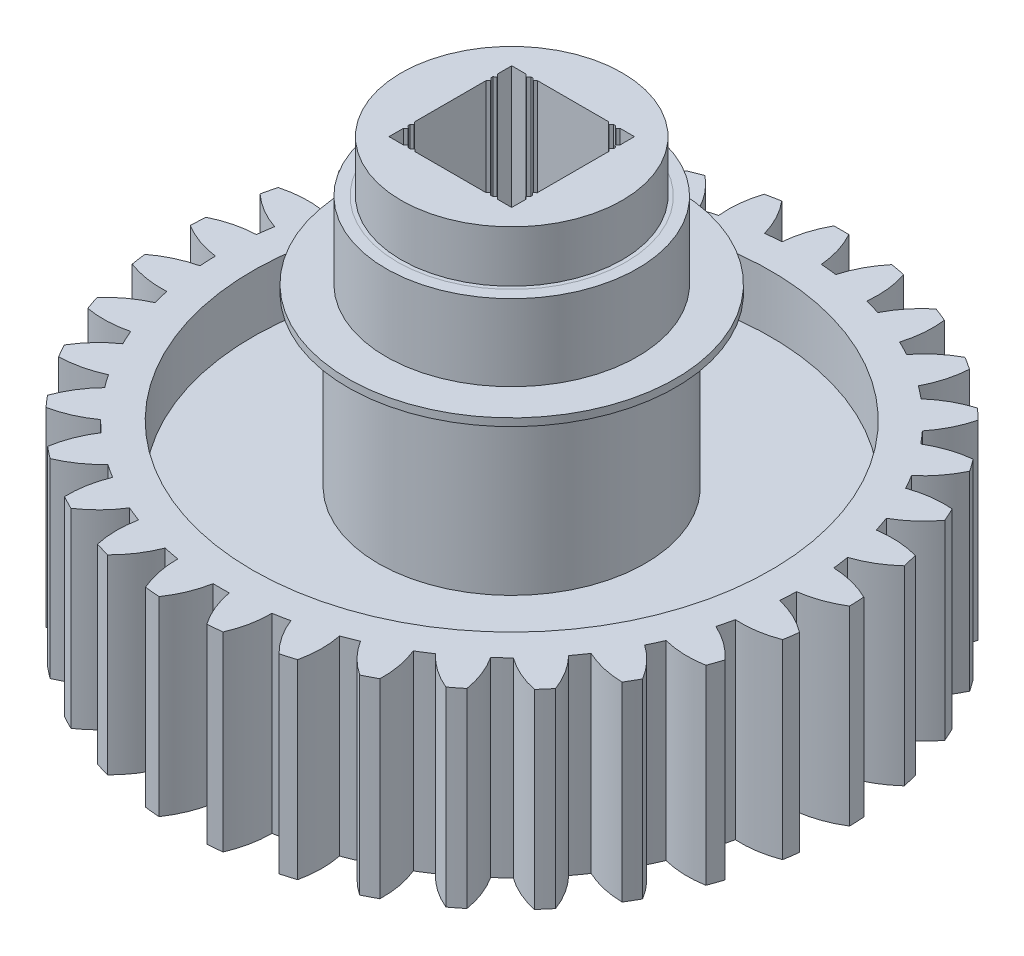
SolidWorks part; units mm, degrees
ref_plane "Front Plane" through (0, 0, 0) normal (0, 0, 1) x (1, 0, 0)
ref_plane "Top Plane" through (0, 0, 0) normal (0, 1, 0) x (1, 0, 0)
ref_plane "Right Plane" through (0, 0, 0) normal (1, 0, 0) x (0, 0, -1)
sketch "Sketch1" plane through (0, 0, 0) normal (0, 0, 1) x (1, 0, 0)
  line L0 (0, 12.8318) -> (0, 0) construction
  line L1 (-2.3, 5.1) -> (-0.3, 5.1)
  line L2 (-2.3, 5.1) -> (-2.3, 2.3)
  line L3 (-2.3, 2.3) -> (-5, 2.3)
  line L4 (-5, 2.3) -> (-5, -1.1)
  line L5 (-5, -1.1) -> (-6, -1.1)
  line L6 (-6, -1.1) -> (-6, 1.5)
  line L7 (-6, 1.5) -> (-6.8, 1.5)
  line L8 (-6.8, 1.5) -> (-6.8, 0)
  line L9 (-6.8, 0) -> (-7.57, 0)
  line L10 (-7.57, 0) -> (-7.57, 5)
  line L11 (-7.57, 5) -> (-6.8, 5)
  line L12 (-6.8, 5) -> (-6.8, 3.5)
  line L13 (-6.8, 3.5) -> (-3.5, 3.5)
  line L14 (-3.5, 3.5) -> (-3.5, 7.9)
  line L15 (-3.5, 7.9) -> (-3, 7.9)
  line L16 (-3, 7.9) -> (-3, 10.1)
  line L17 (-3, 10.1) -> (-2.9, 10.1)
  line L18 (-2.9, 10.1) -> (-2.9, 11.45)
  line L19 (-2.9, 11.45) -> (-0.3, 11.45)
  line L22 (-0.3, 11.45) -> (-0.3, 5.1)
  point P23 (0, 0)
  dimension "D2" = 0.6
  dimension "D3" = 2.8
  dimension "D4" = 2.7
  dimension "D5" = 3.4
  dimension "D6" = 2.6
  dimension "D7" = 1
  dimension "D8" = 0.8
  dimension "D9" = 1.5
  dimension "D10" = 0.77
  dimension "D11" = 5
  dimension "D12" = 3.3
  dimension "D13" = 1.5
  dimension "D14" = 0.5
  dimension "D15" = 4.4
  dimension "D16" = 0.1
  dimension "D17" = 2.2
  dimension "D18" = 15.14
  dimension "D19" = 1.35
revolve "Revolve1" add sketch "Sketch1" angle 360 about L0
sketch "Sketch2" plane through (0, 11.45, 0) normal (0, 1, 0) x (1, 0, 0)
  line L0 (0, -1.8094) -> (0, 2.3037) construction
  line L1 (-1.61, 1.61) -> (1.61, 1.61)
  line L2 (-1.61, 1.61) -> (-1.61, -1.61)
  line L3 (-1.61, -1.61) -> (1.61, -1.61)
  line L4 (1.61, 1.61) -> (1.61, -1.61)
  point P6 (0, 0)
  dimension "D1" = 3.22
  dimension "D2" = 1.61
  dimension "D3" = 3.22
extrude "Cut-Extrude1" cut sketch "Sketch2" against normal blind 5.85
sketch "Sketch3" plane through (0, 2.3, 0) normal (0, -1, 0) x (1, 0, 0)
  line L0 (0, -5) -> (0, 4.809) construction
  line L1 (3, 3.3226) -> (3, 4)
  line L2 (-3, -4) -> (-3, -3.3226)
  line L3 (-3, 3.3226) -> (-3, 4)
  line L4 (0, -4.4) -> (0, -2.4) construction
  line L5 (3, -4) -> (3, -3.3226)
  line L6 (-2.6971, 0) -> (3.3961, 0) construction
  circle A0 centre (0, 0) radius 5 construction
  arc A1 (3.2308, 2.6837) -> (3.2308, -2.6837) centre (0, 0) cw
  arc A2 (3, 4) -> (3, -4) centre (0, 0) cw
  arc A3 (3.2308, 2.6837) -> (3, 3.3226) centre (4, 3.3226) cw
  arc A4 (3, -3.3226) -> (3.2308, -2.6837) centre (4, -3.3226) cw
  circle A5 centre (0, -3.4) radius 1
  arc A6 (-3, -3.3226) -> (-3.2308, -2.6837) centre (-4, -3.3226) ccw
  arc A7 (-3.2308, 2.6837) -> (-3, 3.3226) centre (-4, 3.3226) ccw
  arc A8 (-3, 4) -> (-3, -4) centre (0, 0) ccw
  arc A9 (-3.2308, 2.6837) -> (-3.2308, -2.6837) centre (0, 0) ccw
  circle A10 centre (0, 3.4) radius 1
  point P12 (0, 0)
  dimension "D1" = 1
  dimension "D3" = 4.2
  dimension "D4" = 5
  dimension "D5" = 1
  dimension "D6" = 1
  dimension "D2" = 3.4
  dimension "D7" = 0.6774
  dimension "D8" = 0.6774
  dimension "D9" = 8
  dimension "D10" = 3
  dimension "D11" = 0.2308
  dimension "D12" = 0.2308
extrude "Extrude1" add sketch "Sketch3" along normal blind 1.2
sketch "Sketch4" plane through (0, 0, 0) normal (0, -1, 0) x (1, 0, 0)
  circle A4 centre (0, 0) radius 7.57 construction
  arc A5 (1.2209, 7.4709) -> (-1.2235, 7.4705) centre (0, 0) ccw
  arc A7 (1.2209, 7.4709) -> (1.0032, 8.5916) centre (-1.388, 7.5456) ccw
  arc A8 (1.0032, 8.5916) -> (0.6266, 8.6273) centre (0, 0) ccw
  arc A9 (-1.0038, 8.5916) -> (-1.2235, 7.4705) centre (1.3856, 7.5413) ccw
  arc A10 (-0.6266, 8.6273) -> (-1.0038, 8.5916) centre (0, 0) ccw
  arc A11 (-0.2109, 7.6221) -> (-0.6266, 8.6273) centre (-2.7777, 7.1491) ccw
  arc A12 (0.2109, 7.6221) -> (-0.2109, 7.6221) centre (0, 0) ccw
  arc A13 (0.6266, 8.6273) -> (0.2109, 7.6221) centre (2.7777, 7.1491) ccw
  point P13 (0, 0)
  dimension "D1" = 2.61
  dimension "D2" = 2.61
  dimension "D3" = 2.61
  dimension "D4" = 2.61
  dimension "D5" = 8.65
  dimension "D6" = 8.65
  dimension "D7" = 7.625
  dimension "D8" = 1.1211
  dimension "D10" = 1.0125
  dimension "D11" = 1.01
  dimension "D12" = 0.3788
  dimension "D13" = 0.3782
  dimension "D14" = 1.0052
  dimension "D15" = 1.0052
  dimension "D16" = 7.6221
extrude "Extrude2" add sketch "Sketch4" against normal up to surface (5 mm away)
pattern_circular "CirPattern1" count 33 over 360 about axis through (0, 0, 0) along (0, 1, 0) of "Extrude2"
sketch "Sketch5" plane through (0, 11.45, 0) normal (0, 1, 0) x (-1, 0, 0)
  line L0 (-1.61, 0.941) -> (-1.62, 0.941)
  line L1 (-1.62, 0.941) -> (-1.62, 1.23)
  line L2 (0, 0) -> (-2.4566, 0) construction
  line L3 (-1.61, 1.23) -> (-1.62, 1.23)
  line L4 (1.61, 1.61) -> (-1.61, 1.61) construction
  line L5 (-1.2348, 1.61) -> (-1.1803, 1.5553)
  line L6 (-1.1623, 1.5553) -> (-1.1078, 1.61)
  line L7 (-1.1078, 1.61) -> (-1.057, 1.61)
  line L8 (-1.057, 1.61) -> (-1.0025, 1.5553)
  line L9 (-0.9845, 1.5553) -> (-0.93, 1.61)
  line L10 (-0.93, 1.61) -> (-0.93, 1.6189)
  line L11 (-0.93, 1.6189) -> (-1.2348, 1.6189)
  line L12 (-1.2348, 1.6189) -> (-1.2348, 1.61)
  line L13 (0, 0) -> (0, 2.0737) construction
  line L14 (1.2348, 1.6189) -> (1.2348, 1.61)
  line L15 (0.93, 1.6189) -> (1.2348, 1.6189)
  line L16 (0.93, 1.61) -> (0.93, 1.6189)
  line L17 (0.9845, 1.5553) -> (0.93, 1.61)
  line L18 (1.057, 1.61) -> (1.0025, 1.5553)
  line L19 (1.1078, 1.61) -> (1.057, 1.61)
  line L20 (1.1623, 1.5553) -> (1.1078, 1.61)
  line L21 (1.2348, 1.61) -> (1.1803, 1.5553)
  line L22 (-1.61, 1.61) -> (-1.61, -1.61) construction
  line L23 (-1.5476, -1.18) -> (-1.61, -1.23)
  line L24 (-1.61, -1.1144) -> (-1.5476, -1.1644)
  line L25 (-1.61, 0.941) -> (-1.5513, 0.9954)
  line L26 (-1.5513, 1.01) -> (-1.61, 1.0644)
  line L27 (-1.61, 1.0644) -> (-1.61, 1.1144)
  line L28 (-1.61, 1.1144) -> (-1.5476, 1.1644)
  line L29 (-1.5476, 1.18) -> (-1.61, 1.23)
  line L30 (-1.61, -1.0644) -> (-1.61, -1.1144)
  line L31 (-1.5513, -1.01) -> (-1.61, -1.0644)
  line L32 (-1.61, -0.941) -> (-1.5513, -0.9954)
  line L33 (-1.61, -1.23) -> (-1.62, -1.23)
  line L34 (-1.62, -0.941) -> (-1.62, -1.23)
  line L35 (-1.61, -0.941) -> (-1.62, -0.941)
  arc A0 (1.0025, 1.5553) -> (0.9845, 1.5553) centre (0.9935, 1.5643) cw
  arc A1 (1.1803, 1.5553) -> (1.1623, 1.5553) centre (1.1713, 1.5643) cw
  arc A2 (-1.1803, 1.5553) -> (-1.1623, 1.5553) centre (-1.1713, 1.5643) ccw
  arc A3 (-1.0025, 1.5553) -> (-0.9845, 1.5553) centre (-0.9935, 1.5643) ccw
  arc A4 (-1.5513, 0.9954) -> (-1.5513, 1.01) centre (-1.5581, 1.0027) ccw
  arc A5 (-1.5476, 1.1644) -> (-1.5476, 1.18) centre (-1.5538, 1.1722) ccw
  arc A6 (-1.5476, -1.1644) -> (-1.5476, -1.18) centre (-1.5538, -1.1722) cw
  arc A7 (-1.5513, -0.9954) -> (-1.5513, -1.01) centre (-1.5581, -1.0027) cw
  dimension "D11" = 0.0127
  dimension "D12" = 0.0127
  dimension "D28" = 0.01
  dimension "D29" = 0.38
  dimension "D19" = 0.01
  dimension "D20" = 0.01
  dimension "D1" = 0.3048
  dimension "D2" = 0.0508
  dimension "D3" = 0.0547
  dimension "D4" = 0.0547
  dimension "D5" = 0.0772
  dimension "D6" = 0.0547
  dimension "D7" = 0.0547
  dimension "D8" = 0.0772
  dimension "D9" = 0.0772
  dimension "D10" = 0.0772
  dimension "D13" = 0.0457
  dimension "D14" = 0.93
  dimension "D15" = 0.3048
  dimension "D16" = 0.018
  dimension "D17" = 0.0089
  dimension "D18" = 0.01
  dimension "D21" = 0.08
  dimension "D22" = 0.08
  dimension "D23" = 0.08
  dimension "D24" = 0.08
  dimension "D25" = 0.05
  dimension "D26" = 0.05
  dimension "D27" = 0.0544
extrude "Extrude3" add sketch "Sketch5" against normal up to vertex
mirror "Mirror1" about plane through (0, 0, 0) normal (0, 0, 1) of "Extrude3"
mirror "Mirror2" about plane through (0, 0, 0) normal (1, 0, 0) of "Mirror1"
sketch "Sketch8" plane through (0, 0, 0) normal (0, 0, 1) x (1, 0, 0)
  line L0 (3, 10.1) -> (3, 7.9)
  line L1 (3, 7.9) -> (4.3, 7.9)
  line L2 (4.3, 7.9) -> (4.3, 8.1)
  line L3 (4.3, 8.1) -> (3.3, 8.1)
  line L4 (3.3, 8.1) -> (3.3, 10.1)
  line L5 (3.3, 10.1) -> (3, 10.1)
  line L6 (0, 11.45) -> (0, 5.0581) construction
  line L7 (-0.93, 11.45) -> (0.93, 11.45) construction
  dimension "D1" = 0.2
  dimension "D2" = 0.3
  dimension "D3" = 1
revolve "Revolve2" add sketch "Sketch8" angle 360 about L6
sketch "Sketch9" plane through (0, 0, 0) normal (0, 0, 1) x (1, 0, 0)
  line L0 (5, -0.7) -> (5, 1.1)
  line L1 (3, 1.1) -> (5, 1.1) construction
  line L2 (5, 1.1) -> (4.4, 1.1)
  line L4 (4.4, -0.7) -> (4.4, 1.1)
  line L5 (4.4, -0.7) -> (5, -0.7)
  line L6 (0, 2.3) -> (0, -2.147) construction
  line L7 (-1, 2.3) -> (1, 2.3) construction
  dimension "D1" = 1.8
  dimension "D2" = 10
  dimension "D3" = 0.6
revolve "Revolve3" add sketch "Sketch9" angle 360 about L6
chamfer "Chamfer1" distance 0.2 angle 45 1 edges at (0, -0.7, 4.4)
